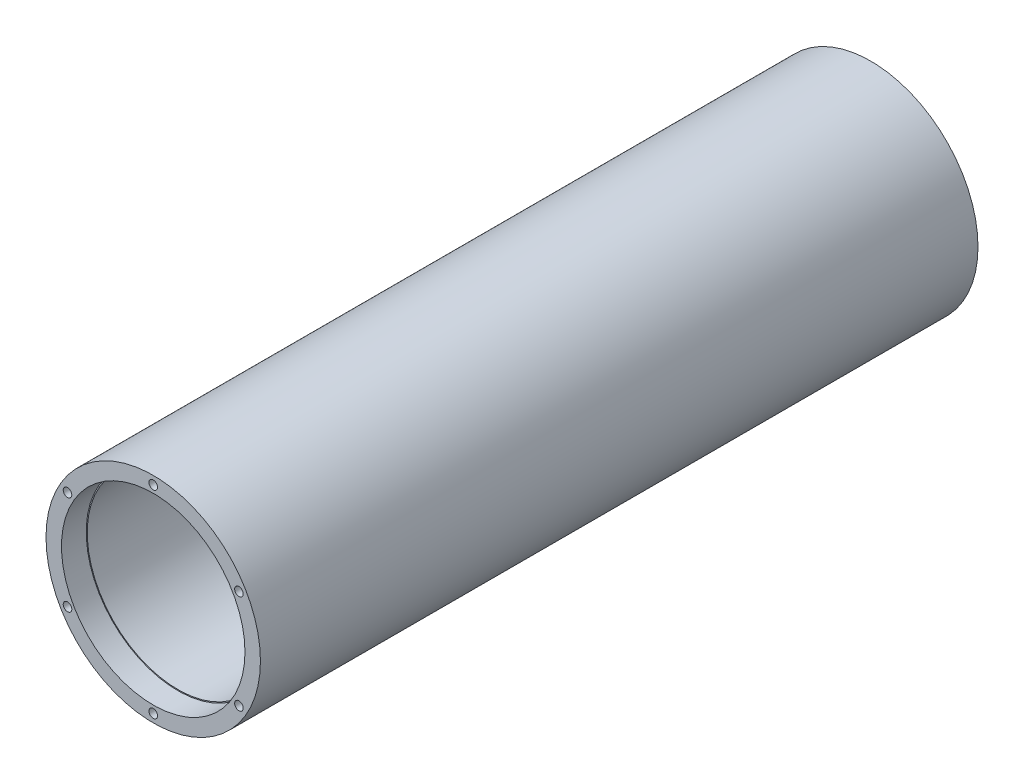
SolidWorks part; units mm, degrees
ref_plane "Front Plane" through (0, 0, 0) normal (0, 0, 1) x (1, 0, 0)
ref_plane "Top Plane" through (0, 0, 0) normal (0, 1, 0) x (1, 0, 0)
ref_plane "Right Plane" through (0, 0, 0) normal (1, 0, 0) x (0, 0, -1)
sketch "Sketch1" plane through (0, 0, 0) normal (0, 0, 1) x (1, 0, 0)
  circle A0 centre (0, 0) radius 82.55
  dimension "D1" = 165.1
extrude "Extrude1" add sketch "Sketch1" along normal blind 577.85
sketch "Sketch2" plane through (0, 0, 577.85) normal (0, 0, 1) x (1, 0, 0)
  circle A0 centre (0, 0) radius 69.85
  dimension "D1" = 139.7
extrude "Cut-Extrude1" cut sketch "Sketch2" against normal blind 508
fillet "Fillet1" radius 6.35 1 edges at (69.85, 0, 69.85)
sketch "Sketch3" plane through (0, 0, 577.85) normal (0, 0, 1) x (1, 0, 0)
  circle A0 centre (0, 0) radius 70.6374
  dimension "D1" = 141.2748
extrude "Cut-Extrude2" cut sketch "Sketch3" against normal blind 19.05
sketch "Sketch4" plane through (0, 0, 577.85) normal (0, 0, 1) x (1, 0, 0)
  circle A0 centre (0, 76.2) radius 3.302
  dimension "D2" = 6.604
  dimension "D1" = 76.2
extrude "Cut-Extrude3" cut sketch "Sketch4" against normal blind 25.4
pattern_circular "CirPattern1" count 6 over 360 about axis through (0, 0, 0) along (0, 0, 1) of "Cut-Extrude3"
sketch "Sketch5" plane through (0, 0, 0) normal (0, 0, -1) x (-1, 0, 0)
  circle A0 centre (0, 0) radius 7.62
  dimension "D1" = 15.24
extrude "Cut-Extrude4" cut sketch "Sketch5" against normal through all
sketch "Sketch6" plane through (0, 0, 0) normal (0, 0, -1) x (-1, 0, 0)
  circle A0 centre (0, 0) radius 38.1
  circle A1 centre (0, 0) radius 113.124
  dimension "D1" = 76.2
  dimension "D2" = 226.248
extrude "Cut-Extrude5" cut sketch "Sketch6" against normal blind 25.4
